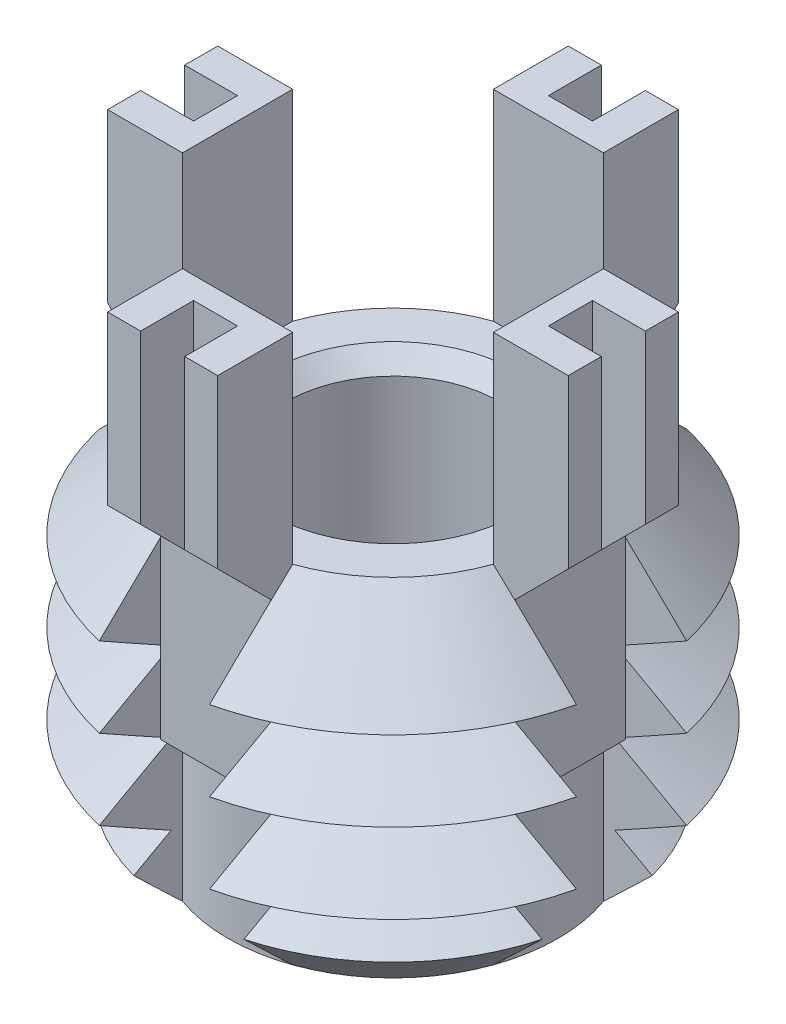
SolidWorks part; units mm, degrees
ref_plane "Front Plane" through (0, 0, 0) normal (0, 0, 1) x (1, 0, 0)
ref_plane "Top Plane" through (0, 0, 0) normal (0, 1, 0) x (1, 0, 0)
ref_plane "Right Plane" through (0, 0, 0) normal (1, 0, 0) x (0, 0, -1)
sketch "Sketch1" plane through (0, 0, 0) normal (0, 1, 0) x (1, 0, 0)
  circle A0 centre (0, 0) radius 5.556
  dimension "D1" = 11.112
extrude "Boss-Extrude1" add sketch "Sketch1" against normal blind 7.874
chamfer "Chamfer1" distance 1.814 angle 45 2 edges at (0, -7.874, 5.556) (0, 0, 5.556)
sketch "Sketch2" plane through (0, 0, 0) normal (1, 0, 0) x (0, 0, -1)
  line L0 (0, 0.8859) -> (0, -9.2617) construction
sketch "Sketch3" plane through (0, 0, 0) normal (1, 0, 0) x (0, 0, -1)
  line L0 (-5.556, -1.814) -> (-3.985, -2.721)
  line L1 (-3.985, -2.721) -> (-5.556, -3.628)
  line L2 (-5.556, -1.814) -> (-5.556, -6.06) construction
  line L3 (-5.556, -3.628) -> (-5.556, -1.814)
  dimension "D1" = 1.814
revolve "Cut-Revolve1" cut sketch "Sketch3" angle 360 about L0
pattern_linear "LPattern1" count 3 spacing 1.814 along (0, -1, 0) of "Cut-Revolve1"
sketch "Sketch4" plane through (0, 0, 0) normal (0, 1, 0) x (1, 0, 0)
  line L0 (-3.527, 1.25) -> (-5.4136, 1.25)
  line L2 (-5.4136, -1.25) -> (-3.527, -1.25)
  arc A0 (-3.527, 1.25) -> (-3.527, -1.25) centre (0, 0) ccw
  arc A1 (-5.4136, 1.25) -> (-5.4136, -1.25) centre (0, 0) ccw
  circle A2 centre (0, 0) radius 5.556 construction
  circle A3 centre (0, 0) radius 3.742 construction
  point P1 (-3.742, 0)
  point P3 (-5.556, 0)
  point P13 (0, 0)
  dimension "D1" = 2.5
extrude "Cut-Extrude1" cut sketch "Sketch4" against normal up to surface (7.874 mm away)
pattern_circular "CirPattern1" count 4 over 360 about axis through (0, 0, 0) along (0, 1, 0) of "Cut-Extrude1"
sketch "Sketch5" plane through (0, 0, 0) normal (1, 0, 0) x (0, 0, -1)
  line L0 (-3.527, 4.558) -> (-3.527, -4.442)
  line L1 (-3.527, -4.442) -> (-4.027, -4.442)
  line L2 (-4.027, -4.442) -> (-4.027, -0.442)
  line L3 (-4.027, -0.442) -> (-5.227, 0.758)
  line L4 (-5.227, 0.758) -> (-5.227, 4.558)
  line L5 (-5.227, 4.558) -> (-3.527, 4.558)
  line L6 (-5.4136, -5.442) -> (-1.25, -5.442) construction
  point P9 (-1.25, 0)
  point P10 (-4.027, -0.442)
  dimension "D1" = 1
  dimension "D2" = 9
  dimension "D3" = 5
  dimension "D4" = 1.7
  dimension "D5" = 0.5
  dimension "D6" = 45
extrude "Boss-Extrude3" add sketch "Sketch5" along normal mid plane 2.5
pattern_circular "CirPattern2" count 4 over 360 about axis through (0, 0, 0) along (0, 1, 0) of "Boss-Extrude3"
sketch "Sketch6" plane through (0, 4.558, 0) normal (0, 1, 0) x (1, 0, 0)
  line L0 (-5.227, -1.25) -> (-5.227, 1.25) construction
  line L1 (-5.227, -0.5) -> (-4.027, -0.5)
  line L2 (-5.227, -0.5) -> (-5.227, 0.5)
  line L3 (-5.227, 0.5) -> (-4.027, 0.5)
  line L4 (-4.027, -0.5) -> (-4.027, 0.5)
  line L5 (-5.227, -0.5) -> (-4.027, 0.5) construction
  line L6 (-5.227, 0.5) -> (-4.027, -0.5) construction
  line L7 (5.227, 1.25) -> (5.227, -1.25) construction
  line L8 (-0.5, 4.027) -> (0.5, 4.027)
  line L9 (-0.5, 4.027) -> (-0.5, 5.227)
  line L10 (-0.5, 5.227) -> (0.5, 5.227)
  line L11 (0.5, 4.027) -> (0.5, 5.227)
  line L12 (-0.5, 4.027) -> (0.5, 5.227) construction
  line L13 (-0.5, 5.227) -> (0.5, 4.027) construction
  line L14 (4.027, -0.5) -> (5.227, -0.5)
  line L15 (4.027, -0.5) -> (4.027, 0.5)
  line L16 (4.027, 0.5) -> (5.227, 0.5)
  line L17 (5.227, -0.5) -> (5.227, 0.5)
  line L18 (4.027, -0.5) -> (5.227, 0.5) construction
  line L19 (4.027, 0.5) -> (5.227, -0.5) construction
  line L20 (-0.5, -5.227) -> (0.5, -5.227)
  line L21 (-0.5, -5.227) -> (-0.5, -4.027)
  line L22 (-0.5, -4.027) -> (0.5, -4.027)
  line L23 (0.5, -5.227) -> (0.5, -4.027)
  line L24 (-0.5, -5.227) -> (0.5, -4.027) construction
  line L25 (-0.5, -4.027) -> (0.5, -5.227) construction
  line L26 (-1.25, 5.227) -> (1.25, 5.227) construction
  line L27 (1.25, -5.227) -> (-1.25, -5.227) construction
  point P0 (-4.627, 0)
  point P7 (-5.227, 0)
  point P8 (-5.227, 0)
  point P9 (0, 4.627)
  point P14 (4.627, 0)
  point P19 (0, -4.627)
  point P24 (0, 5.227)
  point P25 (5.227, 0)
  point P26 (5.227, 0)
  point P27 (0, 5.227)
  point P30 (0, -5.227)
  point P33 (0, -5.227)
  dimension "D1" = 1
  dimension "D2" = 1.2
extrude "Cut-Extrude3" cut sketch "Sketch6" against normal through all both and the other way through all
sketch "Sketch7" plane through (0, 0, 0) normal (0, 1, 0) x (1, 0, 0)
  circle A0 centre (0, 0) radius 2.413
  dimension "D1" = 4.826
extrude "Cut-Extrude4" cut sketch "Sketch7" against normal up to surface (7.874 mm away)
chamfer "Chamfer2" distance 0.397 angle 45 2 edges at (0, 0, 2.413) (0, -7.874, 2.413)
